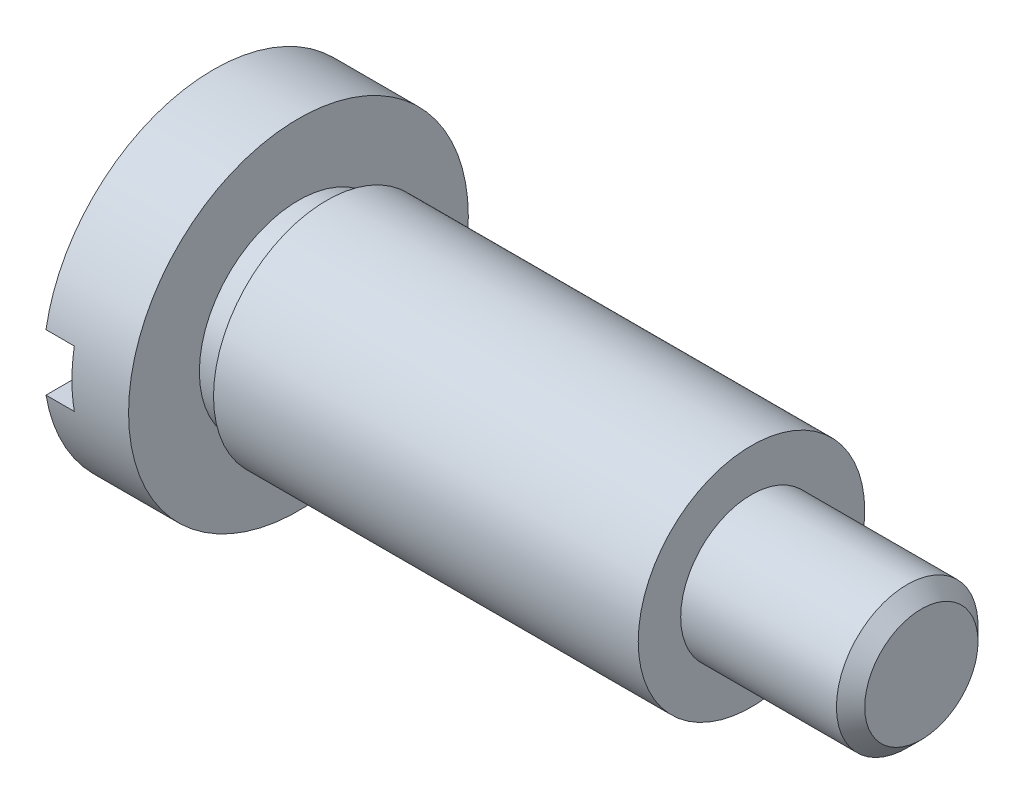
SolidWorks part; units mm, degrees
ref_plane "Plan de face" through (0, 0, 0) normal (0, 0, 1) x (1, 0, 0)
ref_plane "Plan de dessus" through (0, 0, 0) normal (0, 1, 0) x (1, 0, 0)
ref_plane "Plan de droite" through (0, 0, 0) normal (1, 0, 0) x (0, 0, -1)
sketch "Esquisse1" plane through (0, 0, 0) normal (0, 0, 1) x (1, 0, 0)
  line L0 (0, 0) -> (121.0941, 0) construction
  line L1 (0, 0) -> (0, 3)
  line L2 (0, 3) -> (1.5, 3)
  line L3 (1.5, 3) -> (1.5, 2.2399)
  line L4 (2, 2) -> (9.5, 2)
  line L5 (9.5, 2) -> (9.5, 1.25)
  line L6 (9.5, 1.25) -> (12.5, 1.25)
  line L7 (12.5, 1.25) -> (12.5, 0)
  line L8 (12.5, 0) -> (0, 0)
  line L11 (1.5, 2.2399) -> (1.5, 1.75)
  line L12 (1.5, 1.75) -> (2, 1.75)
  line L13 (2, 2) -> (2, 1.75)
  dimension "D1" = 1.5
  dimension "D2" = 9.5
  dimension "D3" = 12.5
  dimension "D4" = 0.5
  dimension "D5" = 3
  dimension "D6" = 2
  dimension "D7" = 1.25
  dimension "D8" = 1.75
revolve "Révolution1" add sketch "Esquisse1" angle 360 about L0
chamfer "Chanfrein1" distance 0.25 angle 45 1 edges at (12.5, 0, 1.25)
sketch "Esquisse2" plane through (0, 0, 0) normal (-1, 0, 0) x (0, 0, 1)
  line L0 (0, 0) -> (4.3745, 0) construction
  line L2 (-3.3525, 0.5) -> (4.1341, 0.5)
  line L3 (-3.3525, 0.5) -> (-3.3525, -0.5)
  line L4 (-3.3525, -0.5) -> (4.1341, -0.5)
  line L5 (4.1341, 0.5) -> (4.1341, -0.5)
  dimension "D1" = 0.5
  dimension "D2" = 1
extrude "Enlèv. mat.-Extru.1" cut sketch "Esquisse2" against normal blind 0.5
